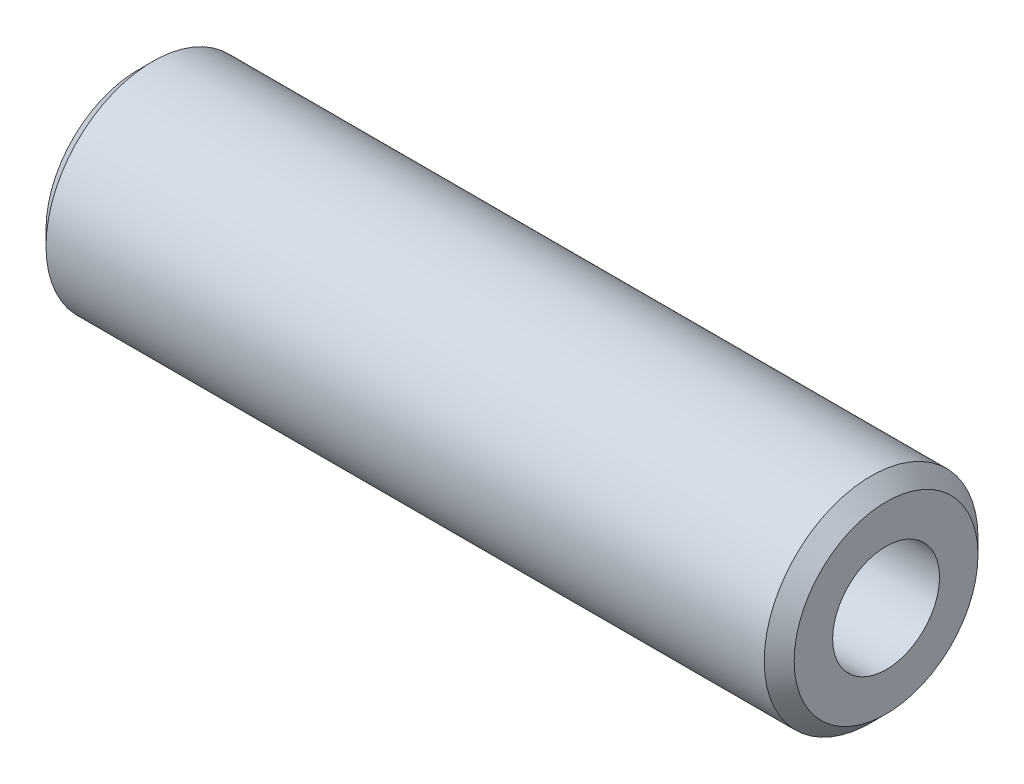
SolidWorks part; units mm, degrees
ref_plane "Front Plane" through (0, 0, 0) normal (0, 0, 1) x (1, 0, 0)
ref_plane "Top Plane" through (0, 0, 0) normal (0, 1, 0) x (1, 0, 0)
ref_plane "Right Plane" through (0, 0, 0) normal (1, 0, 0) x (0, 0, -1)
sketch "Sketch1" plane through (0, 0, 0) normal (0, 0, 1) x (1, 0, 0)
  line L0 (0, 0) -> (43.7114, 0) construction
  line L1 (0, 3.175) -> (44.45, 3.175)
  line L2 (44.45, 3.175) -> (44.45, 6.35)
  line L3 (44.45, 6.35) -> (0, 6.35)
  line L4 (0, 6.35) -> (0, 3.175)
  dimension "D1" = 6.35
  dimension "D2" = 12.7
  dimension "D3" = 44.45
revolve "Revolve1" add sketch "Sketch1" angle 360 about L0
chamfer "Chamfer1" distance 0.889 angle 45 2 edges at (44.45, 0, 6.35) (0, 0, 6.35)
